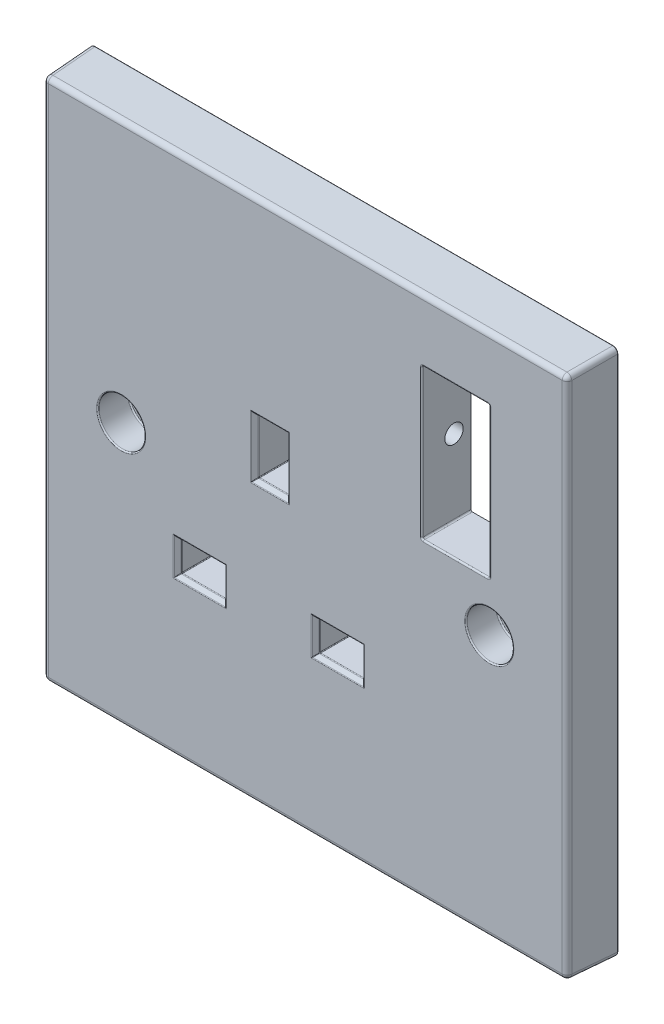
SolidWorks part; units mm, degrees
ref_plane "Front Plane" through (0, 0, 0) normal (0, 0, 1) x (1, 0, 0)
ref_plane "Top Plane" through (0, 0, 0) normal (0, 1, 0) x (1, 0, 0)
ref_plane "Right Plane" through (0, 0, 0) normal (1, 0, 0) x (0, 0, -1)
sketch "Sketch1" plane through (0, 0, 0) normal (0, 0, 1) x (1, 0, 0)
  line L0 (0, -55) -> (0, 55) construction
  line L1 (-43, 43) -> (43, 43)
  line L2 (-43, 43) -> (-43, -43)
  line L3 (-43, -43) -> (43, -43)
  line L4 (43, 43) -> (43, -43)
  line L5 (55, 0) -> (-55, 0) construction
  dimension "D1" = 86
  dimension "D2" = 43
  dimension "D3" = 86
  dimension "D4" = 43
extrude "Boss-Extrude1" add sketch "Sketch1" along normal blind 8
chamfer "Chamfer1" distance 8 angle 2.5 4 edges at (43, 0, 8) (0, -43, 8) (-43, 0, 8) (0, 43, 8)
fillet "Fillet1" radius 0.8 8 edges at (-42.6507, 0, 8) (0, 42.6507, 8) (42.6507, 0, 8) (0, -42.6507, 8) (42.8254, -42.8254, 4) (-42.8254, -42.8254, 4) (42.8254, 42.8254, 4) (-42.8254, 42.8254, 4)
sketch "Sketch2" plane through (0, 0, 8) normal (0, 0, 1) x (1, 0, 0)
  line L0 (4.4, 0) -> (-4.4, 0) construction
  line L1 (-43, 42.2008) -> (-43, -42.2008) construction
  line L2 (43, -42.2008) -> (43, 42.2008) construction
  circle A0 centre (-30, 0) radius 3.8
  circle A1 centre (30, 0) radius 3.8
  dimension "D1" = 7.6
  dimension "D2" = 7.6
  dimension "D3" = 13
  dimension "D4" = 13
extrude "Cut-Extrude1" cut sketch "Sketch2" against normal blind 5
sketch "Sketch3" plane through (0, 0, 3) normal (0, 0, 1) x (1, 0, 0)
  circle A0 centre (-30, 0) radius 1.75
  circle A1 centre (30, 0) radius 1.75
  dimension "D1" = 3.5
  dimension "D2" = 3.5
extrude "Cut-Extrude2" cut sketch "Sketch3" against normal blind 5
fillet "Fillet2" radius 0.2 2 edges at (33.8, 0, 8) (-26.2, 0, 8)
sketch "Sketch4" plane through (0, 0, 8) normal (0, 0, 1) x (1, 0, 0)
  line L0 (-43, 42.2008) -> (-43, -42.2008) construction
  line L1 (19, 32.5) -> (30, 32.5)
  line L2 (19, 32.5) -> (19, 8)
  line L3 (19, 8) -> (30, 8)
  line L4 (30, 32.5) -> (30, 8)
  line L5 (-8.2, 11.6) -> (-3.3, 11.6)
  line L6 (-8.2, 11.6) -> (-8.2, 2.8)
  line L7 (-8.2, 2.8) -> (-3.3, 2.8)
  line L8 (-3.3, 11.6) -> (-3.3, 2.8)
  line L9 (-20.8, -12.2) -> (-13.6, -12.2)
  line L10 (-20.8, -12.2) -> (-20.8, -17)
  line L11 (-20.8, -17) -> (-13.6, -17)
  line L12 (-13.6, -12.2) -> (-13.6, -17)
  line L13 (1.7, -12.2) -> (8.9, -12.2)
  line L14 (1.7, -12.2) -> (1.7, -17)
  line L15 (1.7, -17) -> (8.9, -17)
  line L16 (8.9, -12.2) -> (8.9, -17)
  line L17 (-42.2008, -43) -> (42.2008, -43) construction
  line L18 (42.2008, 43) -> (-42.2008, 43) construction
  line L19 (43, -42.2008) -> (43, 42.2008) construction
  dimension "D1" = 4.8
  dimension "D2" = 4.8
  dimension "D3" = 7.2
  dimension "D4" = 7.2
  dimension "D5" = 8.8
  dimension "D6" = 4.9
  dimension "D7" = 34.8
  dimension "D8" = 22.2
  dimension "D9" = 15.3
  dimension "D10" = 15
  dimension "D11" = 26
  dimension "D12" = 26
  dimension "D13" = 11
  dimension "D14" = 24.5
  dimension "D15" = 10.5
  dimension "D16" = 13
extrude "Cut-Extrude3" cut sketch "Sketch4" against normal blind 15
fillet "Fillet3" radius 0.25 8 edges at (30, 32.5, 4) (19, 32.5, 4) (19, 8, 4) (30, 8, 4) (24.5, 8, 8) (19, 20.25, 8) (24.5, 32.5, 8) (30, 20.25, 8)
chamfer "Chamfer2" distance 0.65 angle 45 12 edges at (8.9, -14.6, 8) (5.3, -17, 8) (1.7, -14.6, 8) (5.3, -12.2, 8) (-20.8, -14.6, 8) (-17.2, -17, 8) (-13.6, -14.6, 8) (-17.2, -12.2, 8) (-5.75, 2.8, 8) (-3.3, 7.2, 8) (-8.2, 7.2, 8) (-5.75, 11.6, 8)
shell "Shell1" thickness 2.5
sketch "Sketch5" plane through (0, 0, 5.5) normal (0, 0, -1) x (-1, 0, 0)
  line L0 (-40.4976, -40.4976) -> (-40.4976, 40.4976) construction
  line L1 (34.9976, -34.9976) -> (41.56, -34.9976)
  line L2 (34.9976, -34.9976) -> (34.9976, -42.4165)
  line L3 (34.9976, -42.4165) -> (41.56, -42.4165)
  line L4 (41.56, -34.9976) -> (41.56, -42.4165)
  line L5 (34.9976, 40.9753) -> (41.1291, 40.9753)
  line L6 (34.9976, 40.9753) -> (34.9976, 34.9976)
  line L7 (34.9976, 34.9976) -> (41.1291, 34.9976)
  line L8 (41.1291, 40.9753) -> (41.1291, 34.9976)
  line L9 (-41.1671, 41.2005) -> (-34.9976, 41.2005)
  line L10 (-41.1671, 41.2005) -> (-41.1671, 34.9976)
  line L11 (-41.1671, 34.9976) -> (-34.9976, 34.9976)
  line L12 (-34.9976, 41.2005) -> (-34.9976, 34.9976)
  line L13 (-40.4976, 40.4976) -> (40.4976, 40.4976) construction
  line L14 (40.4976, 40.4976) -> (40.4976, -40.4976) construction
  line L15 (40.4976, -40.4976) -> (-40.4976, -40.4976) construction
  dimension "D1" = 5.5
  dimension "D2" = 5.5
  dimension "D3" = 5.5
  dimension "D4" = 5.5
  dimension "D5" = 5.5
  dimension "D6" = 5.5
extrude "Boss-Extrude2" add sketch "Sketch5" along normal blind 1
fillet "Fillet4" radius 3 3 edges at (34.9976, 34.9976, 5) (-34.9976, 34.9976, 5) (-34.9976, -34.9976, 5)
sketch "Sketch6" plane through (0, 0, 5.5) normal (0, 0, -1) x (-1, 0, 0)
  line L0 (-41.0289, -24.2) -> (-38.2289, -24.2) construction
  line L1 (-41.0289, -22.65) -> (-38.2289, -22.65)
  line L2 (-41.0289, -25.75) -> (-38.2289, -25.75)
  line L3 (-24.6447, -24.2) -> (-21.8447, -24.2) construction
  line L4 (-24.6447, -22.65) -> (-21.8447, -22.65)
  line L5 (-24.6447, -25.75) -> (-21.8447, -25.75)
  line L6 (-33.0543, -18.3) -> (-30.2543, -18.3) construction
  line L7 (-33.0543, -16.75) -> (-30.2543, -16.75)
  line L8 (-33.0543, -19.85) -> (-30.2543, -19.85)
  line L9 (-33.0543, -30.1) -> (-30.2543, -30.1) construction
  line L10 (-33.0543, -28.55) -> (-30.2543, -28.55)
  line L11 (-33.0543, -31.65) -> (-30.2543, -31.65)
  line L12 (42.2008, -43) -> (-42.2008, -43) construction
  arc A0 (-41.0289, -22.65) -> (-41.0289, -25.75) centre (-41.0289, -24.2) ccw
  arc A1 (-38.2289, -25.75) -> (-38.2289, -22.65) centre (-38.2289, -24.2) ccw
  arc A2 (-24.6447, -22.65) -> (-24.6447, -25.75) centre (-24.6447, -24.2) ccw
  arc A3 (-21.8447, -25.75) -> (-21.8447, -22.65) centre (-21.8447, -24.2) ccw
  arc A4 (-33.0543, -16.75) -> (-33.0543, -19.85) centre (-33.0543, -18.3) ccw
  arc A5 (-30.2543, -19.85) -> (-30.2543, -16.75) centre (-30.2543, -18.3) ccw
  arc A6 (-33.0543, -28.55) -> (-33.0543, -31.65) centre (-33.0543, -30.1) ccw
  arc A7 (-30.2543, -31.65) -> (-30.2543, -28.55) centre (-30.2543, -30.1) ccw
  point P2 (-39.6289, -24.2)
  point P7 (-23.2447, -24.2)
  point P14 (-31.6543, -18.3)
  point P21 (-31.6543, -30.1)
  dimension "D1" = 3.1
  dimension "D2" = 3.1
  dimension "D3" = 3.1
  dimension "D4" = 3.1
  dimension "D5" = 11.8
  dimension "D6" = 2.8
  dimension "D7" = 2.8
  dimension "D8" = 0
  dimension "D9" = 2.8
  dimension "D10" = 2.8
  dimension "D11" = 18.8
  dimension "D12" = 5.9
extrude "Boss-Extrude3" add sketch "Sketch6" along normal blind 4.5
fillet "Fillet5" radius 0.25 18 edges at (40.3557, -22.65, 3.25) (40.3557, -25.75, 3.25) (23.2447, -22.65, 1) (20.2947, -24.2, 1) (23.2447, -25.75, 1) (31.6543, -28.55, 1) (28.7043, -30.1, 1) (31.6543, -31.65, 1) (34.6043, -30.1, 1) (39.3414, -22.65, 1) (36.6789, -24.2, 1) (39.3414, -25.75, 1) (40.454, -24.2, 1) (31.6543, -16.75, 1) (28.7043, -18.3, 1) (31.6543, -19.85, 1) (34.6043, -18.3, 1) (26.1947, -24.2, 1)
sketch "Sketch7" plane through (0, 0, 5.5) normal (0, 0, -1) x (-1, 0, 0)
  line L1 (16.769, 30.2096) -> (34.769, 30.2096)
  line L2 (16.769, 30.2096) -> (16.769, 25.2096)
  line L3 (16.769, 25.2096) -> (34.769, 25.2096)
  line L4 (34.769, 30.2096) -> (34.769, 25.2096)
  dimension "D1" = 18
  dimension "D2" = 5
extrude "Cut-Extrude4" cut sketch "Sketch7" against normal blind 0.2
fillet "Fillet6" radius 0.2 8 edges at (-5.75, 12.25, 8) (-8.85, 7.2, 8) (-5.75, 2.15, 8) (-2.65, 7.2, 8) (-5.75, 2.8, 7.35) (-3.3, 7.2, 7.35) (-5.75, 11.6, 7.35) (-8.2, 7.2, 7.35)
fillet "Fillet7" radius 0.2 12 edges at (1.05, -14.6, 8) (5.3, -17.65, 8) (9.55, -14.6, 8) (5.3, -11.55, 8) (-12.95, -14.6, 8) (-17.2, -11.55, 8) (-21.45, -14.6, 8) (-17.2, -17.65, 8) (-17.2, -17, 7.35) (-17.2, -12.2, 7.35) (-20.8, -14.6, 7.35) (1.7, -14.6, 7.35)
fillet "Fillet8" radius 0.2 4 edges at (8.9, -14.6, 7.35) (5.291, -17, 7.35) (5.291, -12.2, 7.35) (-13.6, -14.6, 7.35)
fillet "Fillet9" radius 0.2 2 edges at (33.8, 0, 3) (-26.2, 0, 3)
sketch "Sketch8" plane through (32.5, 0, 0) normal (1, 0, 0) x (0, 0, -1)
  line L0 (0, 14.1) -> (-5.5, 14.1) construction
  circle A0 centre (-2.75, 20.3) radius 1.5
  dimension "D1" = 3
  dimension "D2" = 6.2
extrude "Cut-Extrude5" cut sketch "Sketch8" against normal blind 30
sketch "Sketch9" plane through (0, 0, 3) normal (0, 0, 1) x (1, 0, 0)
  circle A0 centre (-30, 0) radius 1.8
  circle A1 centre (-30, 0) radius 2.9
  circle A2 centre (30, 0) radius 2.9
  circle A3 centre (30, 0) radius 1.8
  dimension "D1" = 5.8
  dimension "D2" = 3.6
  dimension "D3" = 5.8
  dimension "D4" = 3.6
extrude "Boss-Extrude4" add sketch "Sketch9" along normal blind 0.1
dome "Dome1" faces to dome 2 distance 0.4 parameters "D1"=0.4
dome "Dome2" faces to dome 2 distance 0.4 parameters "D1"=0.4
fillet "Fillet10" radius 0.05 2 edges at (31.75, 0, 3) (-28.25, 0, 3)
fillet "Fillet11" radius 0.1 16 edges at (42.766, 42.766, 0) (0, 43, 0) (-42.766, 42.766, 0) (-43, 0, 0) (-42.766, -42.766, 0) (0, -43, 0) (42.766, -42.766, 0) (43, 0, 0) (-40.4976, 0, 0) (0, 40.4976, 0) (40.4976, 0, 0) (0, -40.4976, 0) (-40.3994, -40.3994, 2.25) (40.3776, -40.3776, 2.75) (-40.3994, 40.3994, 2.25) (40.3994, 40.3994, 2.25)
fillet "Fillet12" radius 0.1 48 edges at (-8.2, 11.6, 3.6336) (-8.2152, 11.6152, 7.3437) (-8.8563, 12.2563, 7.9848) (-2.6437, 12.2563, 7.9848) (-3.3, 11.6, 3.6336) (-3.2848, 11.6152, 7.3437) (-12.9437, -17.6563, 7.9848) (-13.6, -17, 3.6336) (-13.5848, -17.0152, 7.3437) (-21.4563, -17.6563, 7.9848) (-20.8, -17, 3.6336) (-20.8152, -17.0152, 7.3437) (-20.8, -12.2, 3.6336) (-20.8152, -12.1848, 7.3437) (-21.4563, -11.5437, 7.9848) (-13.6, -12.2, 3.6336) (-13.5848, -12.1848, 7.3437) (-12.9437, -11.5437, 7.9848) (9.5563, -11.5437, 7.9848) (8.9, -12.2, 3.6336) (8.9152, -12.1848, 7.3437) (1.0437, -11.5437, 7.9848) (1.7, -12.2, 3.6336) (1.6848, -12.1848, 7.3437) (1.7, -17, 3.6336) (1.6848, -17.0152, 7.3437) (1.0437, -17.6563, 7.9848) (8.9, -17, 3.6336) (8.9152, -17.0152, 7.3437) (9.5563, -17.6563, 7.9848) (-2.6437, 2.1437, 7.9848) (-3.3, 2.8, 3.6336) (-3.2848, 2.7848, 7.3437) (-8.2, 2.8, 3.6336) (-8.2152, 2.7848, 7.3437) (-8.8563, 2.1437, 7.9848) (-8.525, 11.925, 7.675) (-2.975, 11.925, 7.675) (-13.275, -17.325, 7.675) (-21.125, -17.325, 7.675) (-21.125, -11.875, 7.675) (-13.275, -11.875, 7.675) (9.225, -11.875, 7.675) (1.375, -11.875, 7.675) (1.375, -17.325, 7.675) (9.225, -17.325, 7.675) (-2.975, 2.475, 7.675) (-8.525, 2.475, 7.675)
sketch "Sketch11" plane through (0, 0, 5.7) normal (0, 0, -1) x (-1, 0, 0)
  text T0 "ACD" font "Agency FB" height 3.5
extrude "Boss-Extrude5" add sketch "Sketch11" along normal blind 0.2
sketch "Sketch12" plane through (0, 0, 0) normal (0, 0, -1) x (-1, 0, 0)
  line L0 (-8.8, -12.2) -> (-1.8, -12.2) construction
  line L1 (-8.9, -16.9) -> (-8.9, -12.3) construction
  line L2 (-1.8, -17) -> (-8.8, -17) construction
  line L3 (-1.7, -12.3) -> (-1.7, -16.9) construction
  line L4 (10.7, 14.1) -> (0.8, 14.1)
  line L5 (0.8, 14.1) -> (0.8, 0.3)
  line L6 (0.8, 0.3) -> (10.7, 0.3)
  line L7 (10.7, 0.3) -> (10.7, 14.1)
  line L8 (10.7, 14.1) -> (0.8, 14.1)
  line L9 (0.8, 14.1) -> (0.8, 0.3)
  line L10 (0.8, 0.3) -> (10.7, 0.3)
  line L11 (10.7, 0.3) -> (10.7, 14.1)
  line L12 (0.8, -9.7) -> (-11.4, -9.7)
  line L13 (-11.4, -9.7) -> (-11.4, -19.5)
  line L14 (-11.4, -19.5) -> (0.8, -19.5)
  line L15 (0.8, -19.5) -> (0.8, -9.7)
  line L16 (0.8, -9.7) -> (-11.4, -9.7)
  line L17 (-11.4, -9.7) -> (-11.4, -19.5)
  line L18 (-11.4, -19.5) -> (0.8, -19.5)
  line L19 (0.8, -19.5) -> (0.8, -9.7)
  line L20 (23.3, -9.7) -> (11.1, -9.7)
  line L21 (11.1, -9.7) -> (11.1, -19.5)
  line L22 (11.1, -19.5) -> (23.3, -19.5)
  line L23 (23.3, -19.5) -> (23.3, -9.7)
  line L24 (23.3, -9.7) -> (11.1, -9.7)
  line L25 (11.1, -9.7) -> (11.1, -19.5)
  line L26 (11.1, -19.5) -> (23.3, -19.5)
  line L27 (23.3, -19.5) -> (23.3, -9.7)
  line L28 (8.3, 2.9) -> (8.3, 11.5) construction
  line L29 (3.4, 2.7) -> (8.1, 2.7) construction
  line L30 (3.2, 11.5) -> (3.2, 2.9) construction
  line L31 (8.1, 11.7) -> (3.4, 11.7) construction
  line L32 (13.6, -16.9) -> (13.6, -12.3) construction
  line L33 (13.7, -12.2) -> (20.7, -12.2) construction
  line L34 (20.7, -17) -> (13.7, -17) construction
  line L35 (20.8, -12.3) -> (20.8, -16.9) construction
  line L36 (-8.8, -12.2) -> (-1.8, -12.2)
  line L37 (-8.9, -16.9) -> (-8.9, -12.3)
  line L38 (-1.8, -17) -> (-8.8, -17)
  line L39 (-1.7, -12.3) -> (-1.7, -16.9)
  line L40 (8.3, 2.9) -> (8.3, 11.5)
  line L41 (3.4, 2.7) -> (8.1, 2.7)
  line L42 (3.2, 11.5) -> (3.2, 2.9)
  line L43 (8.1, 11.7) -> (3.4, 11.7)
  line L44 (13.6, -16.9) -> (13.6, -12.3)
  line L45 (13.7, -12.2) -> (20.7, -12.2)
  line L46 (20.7, -17) -> (13.7, -17)
  line L47 (20.8, -12.3) -> (20.8, -16.9)
  arc A0 (-8.8, -12.2) -> (-8.9, -12.3) centre (-8.8, -12.3) ccw construction
  arc A1 (-8.9, -16.9) -> (-8.8, -17) centre (-8.8, -16.9) ccw construction
  arc A2 (-1.8, -17) -> (-1.7, -16.9) centre (-1.8, -16.9) ccw construction
  arc A3 (-1.7, -12.3) -> (-1.8, -12.2) centre (-1.8, -12.3) ccw construction
  arc A4 (8.1, 2.7) -> (8.3, 2.9) centre (8.1, 2.9) ccw construction
  arc A5 (3.2, 2.9) -> (3.4, 2.7) centre (3.4, 2.9) ccw construction
  arc A6 (3.4, 11.7) -> (3.2, 11.5) centre (3.4, 11.5) ccw construction
  arc A7 (8.3, 11.5) -> (8.1, 11.7) centre (8.1, 11.5) ccw construction
  arc A8 (13.7, -12.2) -> (13.6, -12.3) centre (13.7, -12.3) ccw construction
  arc A9 (13.6, -16.9) -> (13.7, -17) centre (13.7, -16.9) ccw construction
  arc A10 (20.8, -12.3) -> (20.7, -12.2) centre (20.7, -12.3) ccw construction
  arc A11 (20.7, -17) -> (20.8, -16.9) centre (20.7, -16.9) ccw construction
  arc A12 (-8.8, -12.2) -> (-8.9, -12.3) centre (-8.8, -12.3) ccw
  arc A13 (-8.9, -16.9) -> (-8.8, -17) centre (-8.8, -16.9) ccw
  arc A14 (-1.8, -17) -> (-1.7, -16.9) centre (-1.8, -16.9) ccw
  arc A15 (-1.7, -12.3) -> (-1.8, -12.2) centre (-1.8, -12.3) ccw
  arc A16 (8.1, 2.7) -> (8.3, 2.9) centre (8.1, 2.9) ccw
  arc A17 (3.2, 2.9) -> (3.4, 2.7) centre (3.4, 2.9) ccw
  arc A18 (3.4, 11.7) -> (3.2, 11.5) centre (3.4, 11.5) ccw
  arc A19 (8.3, 11.5) -> (8.1, 11.7) centre (8.1, 11.5) ccw
  arc A20 (13.7, -12.2) -> (13.6, -12.3) centre (13.7, -12.3) ccw
  arc A21 (13.6, -16.9) -> (13.7, -17) centre (13.7, -16.9) ccw
  arc A22 (20.8, -12.3) -> (20.7, -12.2) centre (20.7, -12.3) ccw
  arc A23 (20.7, -17) -> (20.8, -16.9) centre (20.7, -16.9) ccw
  dimension "D1" = 0
  dimension "D2" = 0
  dimension "D3" = 0
extrude "Boss-Extrude6" add sketch "Sketch12" along normal blind 10
